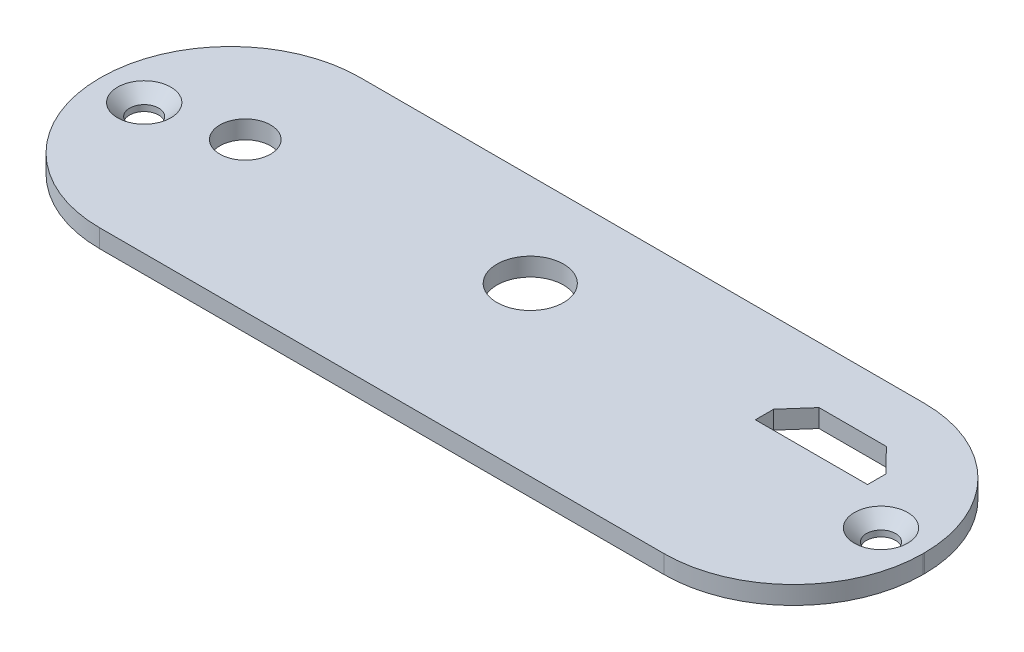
SolidWorks part; units mm, degrees
ref_plane "Front Plane" through (0, 0, 0) normal (0, 0, 1) x (1, 0, 0)
ref_plane "Top Plane" through (0, 0, 0) normal (0, 1, 0) x (1, 0, 0)
ref_plane "Right Plane" through (0, 0, 0) normal (1, 0, 0) x (0, 0, -1)
sketch "Sketch1" plane through (0, 0, 0) normal (0, 1, 0) x (1, 0, 0)
  line L1 (10.7, 0) -> (57.3, 0)
  line L2 (0, 10.7) -> (0, 10.8)
  line L3 (10.7, 21.5) -> (57.3, 21.5)
  line L4 (68, 10.7) -> (68, 10.8)
  arc A0 (10.7, 0) -> (0, 10.7) centre (10.7, 10.7) cw
  arc A1 (0, 10.8) -> (10.7, 21.5) centre (10.7, 10.8) cw
  arc A2 (57.3, 0) -> (68, 10.7) centre (57.3, 10.7) ccw
  arc A3 (57.3, 21.5) -> (68, 10.8) centre (57.3, 10.8) cw
  point P7 (0, 0)
  dimension "D1" = 10.7
  dimension "D2" = 10.7
extrude "Boss-Extrude1" add sketch "Sketch1" along normal blind 1.5
hole_wizard "CSK for M2 Flat Head Machine Screw1" positions "Sketch3" profile "Sketch4" countersink size "M2" standard "ANSI Metric"
sketch "Sketch3" plane through (0, 1.5, 0) normal (0, 1, 0) x (1, 0, 0)
  point P0 (3.578, 10.8)
  point P2 (64.4236, 10.8)
sketch "Sketch4" plane through (3.578, 1.5, -10.8) normal (1, 0, 0) x (0, 0, 1)
  line L0 (0, 0) -> (0, 1.5)
  line L1 (0, 1.5) -> (1.2, 1.5)
  line L2 (1.2, 1.5) -> (1.2, 1)
  line L3 (1.2, 1) -> (2.2, 0)
  line L5 (2.2, 0) -> (0, 0)
  line L6 (-1.2, 1) -> (-2.2, 0) construction
  line L11 (0, -6.35) -> (0, 107.95) construction
  dimension "Thru Hole Dia." = 2.4
  dimension "Thru Hole Depth" = 1.5
  dimension "Near C'Sink Dia." = 4.4
  dimension "Near C'Sink Angle" = 90
sketch "Sketch5" plane through (0, 1.5, 0) normal (0, 1, 0) x (1, 0, 0)
  line L0 (51.5046, 13.341) -> (51.5046, 14.8527)
  line L4 (60.7688, 13.341) -> (60.7688, 14.8527)
  line L9 (60.7688, 13.341) -> (51.5046, 13.341)
  line L17 (53.2603, 16.8439) -> (58.8233, 16.8439)
  line L22 (60.7688, 14.8527) -> (58.8233, 16.8439)
  line L23 (53.2603, 16.8439) -> (51.5046, 14.8527)
  circle A1 centre (32.4515, 13.8069) radius 2.7515
  circle A2 centre (10.4, 12.3214) radius 2.0926
  point P0 (60.7688, 14.8527)
extrude "Cut-Extrude1" cut sketch "Sketch5" against normal blind 1.5
